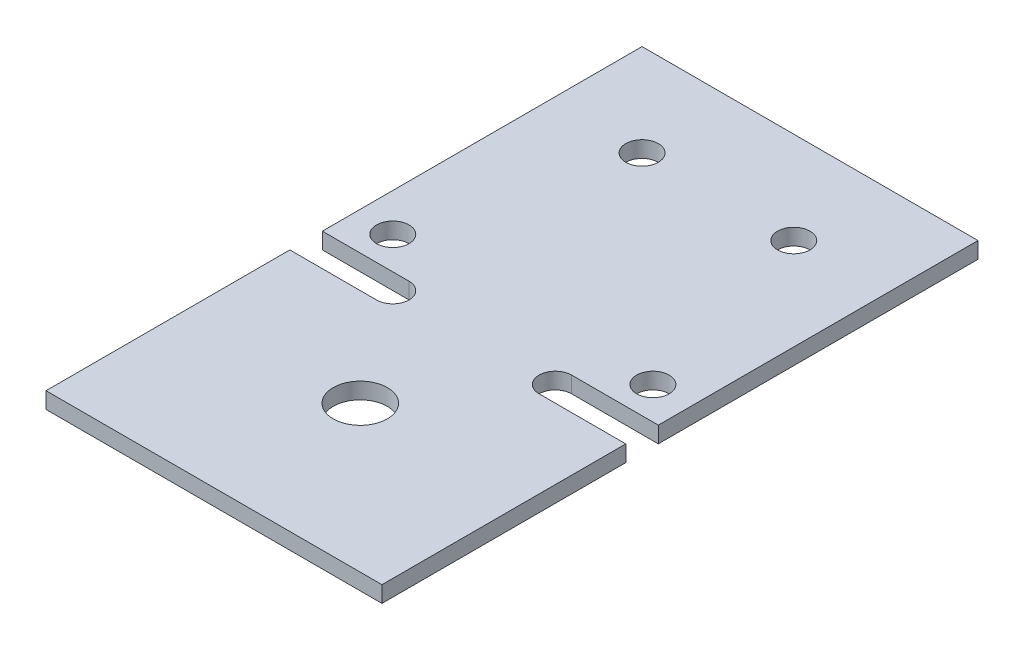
SolidWorks part; units mm, degrees
ref_plane "Front" through (0, 0, 0) normal (0, 0, 1) x (1, 0, 0)
ref_plane "Top" through (0, 0, 0) normal (0, 1, 0) x (1, 0, 0)
ref_plane "Right" through (0, 0, 0) normal (1, 0, 0) x (0, 0, -1)
sketch "Sketch1" plane through (0, 0, 0) normal (0, 1, 0) x (1, 0, 0)
  line L0 (0, 45) -> (16, 45)
  line L1 (0, 0) -> (62, 0)
  line L2 (0, 0) -> (0, 45)
  line L3 (0, 110) -> (62, 110)
  line L4 (62, 0) -> (62, 45)
  line L5 (46, 51) -> (62, 51)
  line L6 (0, 51) -> (16, 51)
  line L7 (46, 45) -> (62, 45)
  line L8 (0, 51) -> (0, 110)
  line L9 (62, 51) -> (62, 110)
  circle A0 centre (31, 27) radius 5
  arc A1 (16, 45) -> (16, 51) centre (16, 48) ccw
  arc A2 (46, 51) -> (46, 45) centre (46, 48) ccw
  circle A3 centre (17, 93) radius 3
  circle A4 centre (45, 93) radius 3
  circle A5 centre (7, 57) radius 3
  circle A6 centre (55, 57) radius 3
extrude "Extrude1" add sketch "Sketch1" along normal blind 3
